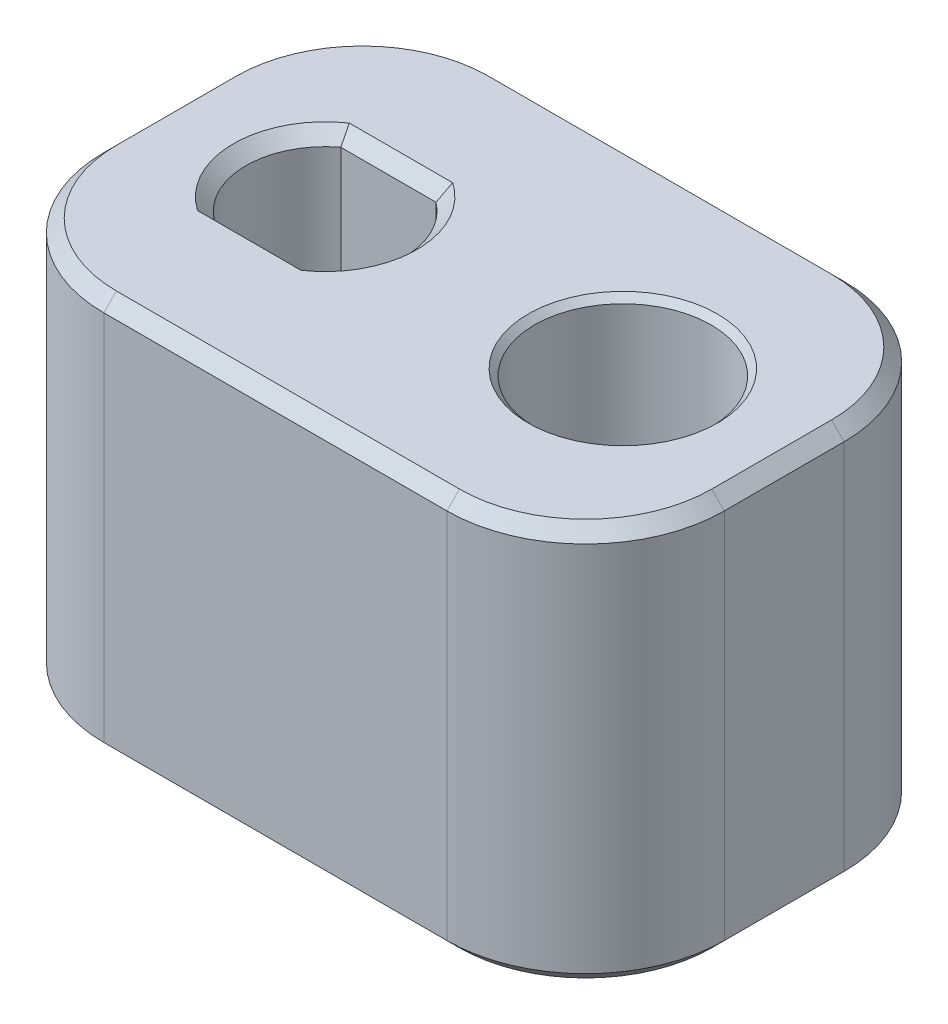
SolidWorks part; units mm, degrees
ref_plane "Front Plane" through (0, 0, 0) normal (0, 0, 1) x (1, 0, 0)
ref_plane "Top Plane" through (0, 0, 0) normal (0, 1, 0) x (1, 0, 0)
ref_plane "Right Plane" through (0, 0, 0) normal (1, 0, 0) x (0, 0, -1)
sketch "Sketch1" plane through (0, 0, 0) normal (0, 1, 0) x (1, 0, 0)
  line L1 (-12.4968, -8.001) -> (12.4968, -8.001)
  line L2 (-12.4968, -8.001) -> (-12.4968, 8.001)
  line L3 (-12.4968, 8.001) -> (12.4968, 8.001)
  line L4 (12.4968, -8.001) -> (12.4968, 8.001)
  line L5 (-12.4968, -8.001) -> (12.4968, 8.001) construction
  line L6 (-12.4968, 8.001) -> (12.4968, -8.001) construction
  point P0 (0, 0)
  dimension "D1" = 24.9936
  dimension "D2" = 16.002
extrude "Extrude1" add sketch "Sketch1" along normal blind 16.002
fillet "Fillet1" radius 5.588 4 edges at (-12.4968, 8.001, -8.001) (-12.4968, 8.001, 8.001) (12.4968, 8.001, -8.001) (12.4968, 8.001, 8.001)
sketch "Sketch4" plane through (0, 16.002, 0) normal (0, 1, 0) x (1, 0, 0)
  line L0 (-7.9121, 2.5463) -> (-4.0767, 2.5463)
  line L1 (-0.2714, 0) -> (-16.7902, 0) construction
  line L2 (-7.9121, -2.5464) -> (-4.0767, -2.5464)
  arc A0 (-4.0767, -2.5464) -> (-4.0767, 2.5463) centre (-5.9944, 0) ccw
  arc A1 (-7.9121, 2.5463) -> (-7.9121, -2.5464) centre (-5.9944, 0) ccw
  dimension "D2" = 6.3754
  dimension "D3" = 5.9944
  dimension "D1" = 5.0927
extrude "Extrude2" cut sketch "Sketch4" against normal through all
chamfer "Chamfer2" distance 0.508 angle 45 8 edges at (-2.8067, 16.002, 0) (-5.9944, 16.002, 2.5464) (-9.1821, 16.002, 0) (-5.9944, 16.002, -2.5463) (-5.9944, 0, 2.5464) (-2.8067, 0, 0) (-9.1821, 0, 0) (-5.9944, 0, -2.5463)
sketch "Sketch3" plane through (0, 0, 0) normal (0, 0, 1) x (1, 0, 0)
  line L0 (5.9944, -4.1204) -> (5.9944, 20.8145) construction
  line L1 (5.9944, 16.002) -> (2.1844, 16.002)
  line L2 (-6.9088, 16.002) -> (6.9088, 16.002) construction
  line L3 (2.4384, 7.112) -> (0.8382, 7.112)
  line L4 (0.8382, 7.112) -> (0.8382, 0.508)
  line L5 (2.4384, 15.748) -> (2.4384, 7.112)
  line L6 (-6.9088, 0) -> (6.9088, 0) construction
  line L7 (0.3302, 0) -> (5.9944, 0)
  line L8 (5.9944, 0) -> (5.9944, 16.002)
  line L9 (2.4384, 15.748) -> (2.1844, 16.002)
  line L10 (0.8382, 0.508) -> (0.3302, 0)
  dimension "D1" = 5.9944
  dimension "D2" = 7.112
  dimension "D3" = 10.3124
  dimension "D4" = 0.508
  dimension "D5" = 45
  dimension "D6" = 0.254
  dimension "D7" = 45
  dimension "D8" = 7.112
revolve "Cut-Revolve2" cut sketch "Sketch3" angle 360 about L0
chamfer "Chamfer1" distance 0.508 angle 45 16 edges at (0, 0, -8.001) (-10.8601, 0, -6.3643) (10.8601, 0, -6.3643) (-12.4968, 0, 0) (12.4968, 0, 0) (-10.8601, 0, 6.3643) (10.8601, 0, 6.3643) (0, 0, 8.001) (0, 16.002, -8.001) (-10.8601, 16.002, -6.3643) (10.8601, 16.002, -6.3643) (-12.4968, 16.002, 0) (12.4968, 16.002, 0) (-10.8601, 16.002, 6.3643) (10.8601, 16.002, 6.3643) (0, 16.002, 8.001)
